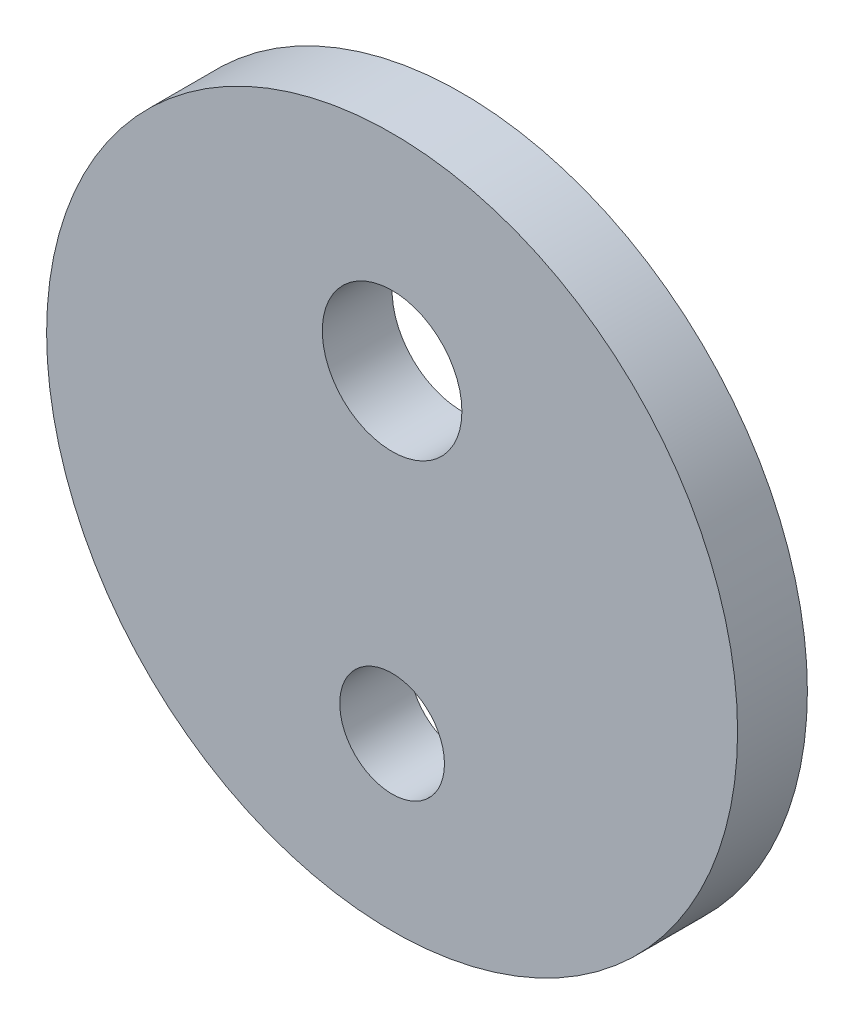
SolidWorks part; units mm, degrees
ref_plane "Front" through (0, 0, 0) normal (0, 0, 1) x (1, 0, 0)
ref_plane "Top" through (0, 0, 0) normal (0, 1, 0) x (1, 0, 0)
ref_plane "Right" through (0, 0, 0) normal (1, 0, 0) x (0, 0, -1)
sketch "Sketch1" plane through (0, 0, 0) normal (0, 0, 1) x (1, 0, 0)
  line L0 (0, 0) -> (35, 0) construction
  line L1 (0, 0) -> (35, 35) construction
  line L2 (35, 0) -> (35, 35) construction
  line L3 (0, 42.5811) -> (0, 50042.5811) construction
  circle A0 centre (0, 0) radius 49.4975
  circle A1 centre (0, 20) radius 10
  circle A2 centre (0, -25) radius 7.5
  dimension "D4" = 45
  dimension "D5" = 15
  dimension "D6" = 20
  dimension "D1" = 45
  dimension "D2" = 35
  dimension "D3" = 20
extrude "Extrude1" add sketch "Sketch1" along normal blind 10
